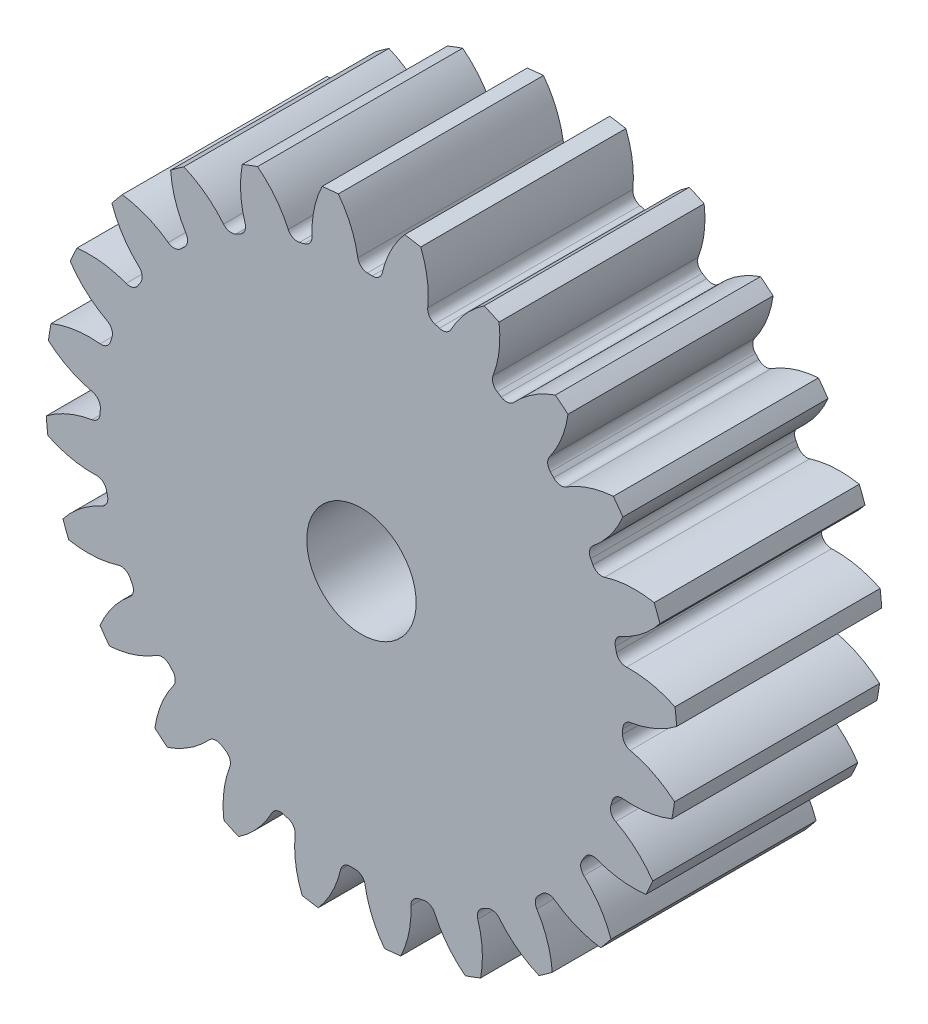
SolidWorks part; units mm, degrees
ref_plane "Front" through (0, 0, 0) normal (0, 0, 1) x (1, 0, 0)
ref_plane "Top" through (0, 0, 0) normal (0, 1, 0) x (1, 0, 0)
ref_plane "Right" through (0, 0, 0) normal (1, 0, 0) x (0, 0, -1)
sketch "Sketch3" plane through (0, 0, 0) normal (0, 0, 1) x (1, 0, 0)
  circle A0 centre (0, 0) radius 146.7556
  dimension "od" = 293.5111
extrude "gearBody" add sketch "Sketch3" along normal blind 95.25
sketch "Sketch2" plane through (0, 0, 0) normal (0, 0, 1) x (1, 0, 0)
  line L0 (0, 0) -> (117.6071, 48.7145) construction
  line L1 (145.7524, -20.3716) -> (0, 0) construction
  line L2 (0, 0) -> (36.3143, 0) construction
  line L3 (135.3915, 4.5132) -> (134.8273, -13.1465) construction
  line L5 (135.1094, -4.3166) -> (0, 0) construction
  line L7 (0, 0) -> (127.297, 0) construction
  arc A0 (127.2803, 2.0619) -> (126.8891, -10.1824) centre (0, 0) ccw construction
  arc A1 (146.3631, 10.726) -> (145.3799, -20.0469) centre (0, 0) ccw construction
  arc A2 (135.3915, 4.5132) -> (134.8273, -13.1465) centre (0, 0) ccw construction
  arc A3 (121.2527, -4.9947) -> (121.3243, -2.7554) centre (0, 0) ccw
  arc A4 (145.7524, -20.3716) -> (124.8244, -9.664) centre (114.2577, -56.1223) ccw
  arc A5 (145.7524, -20.3716) -> (146.7556, 11.0263) centre (0, 0) ccw
  arc A6 (146.7556, 11.0263) -> (125.1867, 1.6764) centre (117.6071, 48.7145) cw
  arc A7 (121.3243, -2.7554) -> (125.1867, 1.6764) centre (125.9177, -2.8597) cw
  arc A8 (124.8244, -9.664) -> (121.2527, -4.9947) centre (125.8434, -5.1838) cw
  point P6 (146.7556, 11.0263)
  point P22 (145.7524, -20.3716)
  dimension "baseDia" = 254.5941
  dimension "od" = 293.5111
  dimension "pd" = 270.9333
  dimension "rd" = 242.7111
  dimension "rFillet" = 4.5946
  dimension "pointX" = 146.7556
  dimension "pointY" = 11.0263
  dimension "CTT" = 17.6597
  dimension "flankCenterAngle" = 22.5
extrude "toothCut" cut sketch "Sketch2" along normal through all
pattern_circular "CirPattern1" count 24 over 360 about axis through (0, 0, 0) along (0, 0, 1) of "toothCut"
sketch "hub1Dia" plane through (0, 0, 0) normal (0, 0, -1) x (-1, 0, 0)
  circle A0 centre (0, 0) radius 12.7
  dimension "hub1Dia" = 25.4
sketch "hub2Dia" plane through (0, 0, 95.25) normal (0, 0, 1) x (1, 0, 0)
  circle A0 centre (0, 0) radius 12.7
  dimension "hub2dia" = 25.4
sketch "boreDia" plane through (0, 0, 0) normal (0, 0, 1) x (1, 0, 0)
  circle A0 centre (0, 0) radius 25.4
  dimension "boreDia" = 50.8
extrude "bore" cut sketch "boreDia" against normal mid plane 25400
